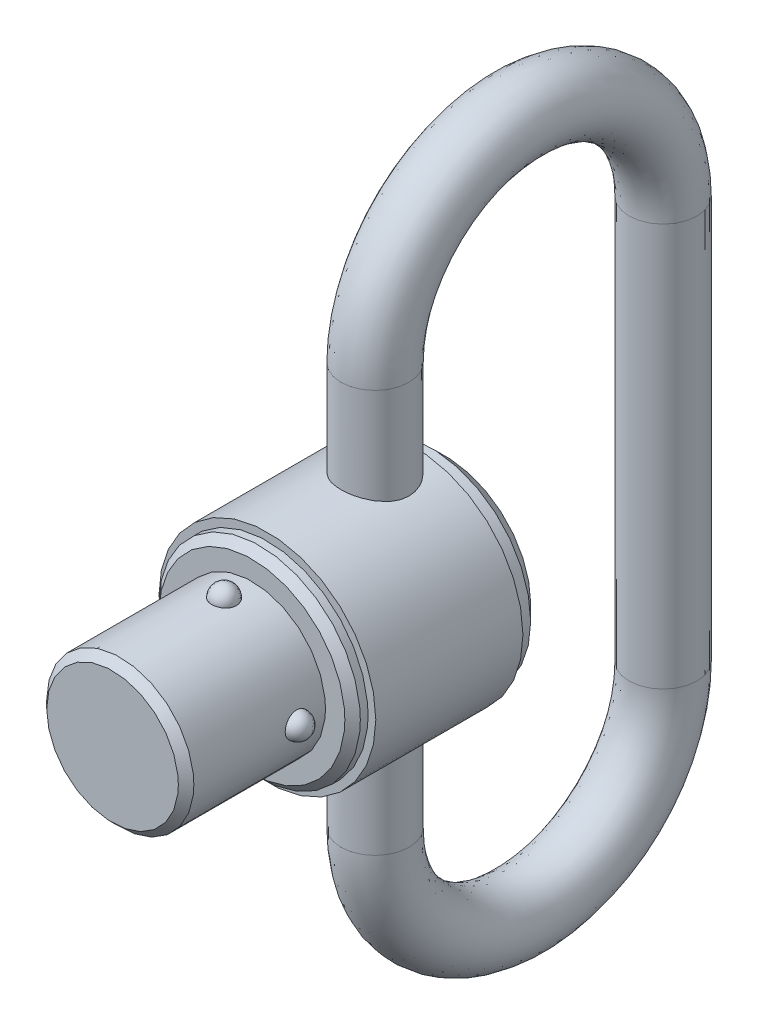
SolidWorks part; units mm, degrees
ref_plane "Front Plane" through (0, 0, 0) normal (0, 0, 1) x (1, 0, 0)
ref_plane "Top Plane" through (0, 0, 0) normal (0, 1, 0) x (1, 0, 0)
ref_plane "Right Plane" through (0, 0, 0) normal (1, 0, 0) x (0, 0, -1)
sketch "Sketch1" plane through (0, 0, 0) normal (0, 0, 1) x (1, 0, 0)
  circle A0 centre (0, 0) radius 7
  dimension "D1" = 14
extrude "Boss-Extrude3" add sketch "Sketch1" along normal mid plane 9.5
sketch "Sketch5" plane through (0, 0, 4.75) normal (0, 0, 1) x (1, 0, 0)
  circle A0 centre (0, 0) radius 6.5
  dimension "D1" = 13
extrude "Boss-Extrude4" add sketch "Sketch5" along normal blind 1
sketch "Sketch6" plane through (0, 0, -4.75) normal (0, 0, -1) x (-1, 0, 0)
  circle A0 centre (0, 0) radius 6.5
  dimension "D1" = 13
extrude "Boss-Extrude5" add sketch "Sketch6" along normal blind 2
chamfer "Chamfer1" distance 1 angle 45 1 edges at (-6.5, 0, -6.75)
sketch "Sketch7" plane through (0, 0, 5.75) normal (0, 0, 1) x (1, 0, 0)
  circle A0 centre (0, 0) radius 4.75
  dimension "D1" = 9.5
extrude "Boss-Extrude6" add sketch "Sketch7" along normal blind 9
sketch "Sketch8" plane through (0, 0, 0) normal (1, 0, 0) x (0, 0, -1)
  line L0 (-22.2378, 0) -> (10.5916, 0) construction
sketch "Sketch9" plane through (0, 0, 0) normal (1, 0, 0) x (0, 0, -1)
  line L0 (-5.75, 4.75) -> (-14.75, 4.75) construction
  line L1 (-8.35, 4.75) -> (-6.75, 4.75)
  line L2 (-5.75, 6.5) -> (-5.75, -6.5) construction
  line L3 (-22.2378, 0) -> (10.5916, 0) construction
  line L5 (-5.75, 4.75) -> (-5.75, -4.75) construction
  arc A0 (-6.75, 4.75) -> (-8.35, 4.75) centre (-7.55, 4.75) ccw
  point P7 (-7.55, 5.55)
  dimension "D1" = 1
  dimension "D2" = 5.55
revolve "Revolve3" add sketch "Sketch9" angle 360 about L1
pattern_circular "CirPattern3" count 4 over 360 about axis through (0, 0, 0) along (0, 0, 1) of "Revolve3"
chamfer "Chamfer2" distance 0.5 angle 45 2 edges at (6.5, 0, 5.75) (4.75, 0, 14.75)
sketch "Sketch11" plane through (0, 0, 0) normal (1, 0, 0) x (0, 0, -1)
  line L0 (23, 13) -> (23, -13)
  line L2 (0, -13) -> (0, 13)
  arc A0 (23, 13) -> (0, 13) centre (11.5, 13) ccw
  arc A1 (0, -13) -> (23, -13) centre (11.5, -13) ccw
  point P1 (11.5, 24.5)
  point P2 (0, 13)
  point P5 (11.5, -24.5)
  point P6 (0, -13)
  dimension "D1" = 24.5
  dimension "D3" = 23
  dimension "D2" = 24.5
sketch "Sketch12" plane through (0, 0, 0) normal (0, 1, 0) x (1, 0, 0)
  line L0 (0, 0) -> (0, 23) construction
  circle A0 centre (0, 2.2) radius 2.2
  point P4 (0, 0)
  point P5 (0, 0)
  dimension "D1" = 4.4
sweep "Sweep1" add profiles "Sketch12" path "Sketch11"
